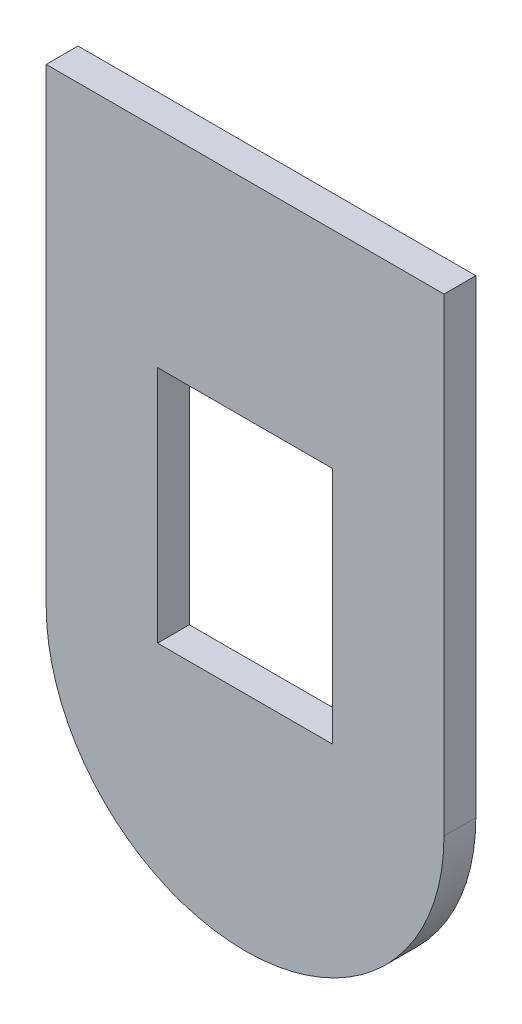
SolidWorks part; units mm, degrees
ref_plane "Face" through (0, 0, 0) normal (0, 0, 1) x (1, 0, 0)
ref_plane "Dessus" through (0, 0, 0) normal (0, 1, 0) x (1, 0, 0)
ref_plane "Droite" through (0, 0, 0) normal (1, 0, 0) x (0, 0, -1)
sketch "Esquisse1" plane through (0, 0, 0) normal (0, 0, 1) x (1, 0, 0)
  line L3 (-12.5, -1) -> (-12.5, -30.5)
  line L4 (-12.5, -1) -> (12.5, -1)
  line L5 (12.5, -1) -> (12.5, -30.5)
  line L7 (-5.5, -14) -> (5.5, -14)
  line L8 (-5.5, -14) -> (-5.5, -29)
  line L9 (-5.5, -29) -> (5.5, -29)
  line L10 (5.5, -14) -> (5.5, -29)
  arc A2 (12.5, -30.5) -> (-12.5, -30.5) centre (0, -30.5) cw
  dimension "D4" = 12.5
  dimension "D1" = 1
  dimension "D2" = 25
  dimension "D3" = 30.5
  dimension "D5" = 12.5
  dimension "D6" = 15
  dimension "D7" = 11
  dimension "D8" = 5.5
  dimension "D9" = 13
extrude "Extrusion1" add sketch "Esquisse1" along normal blind 2
